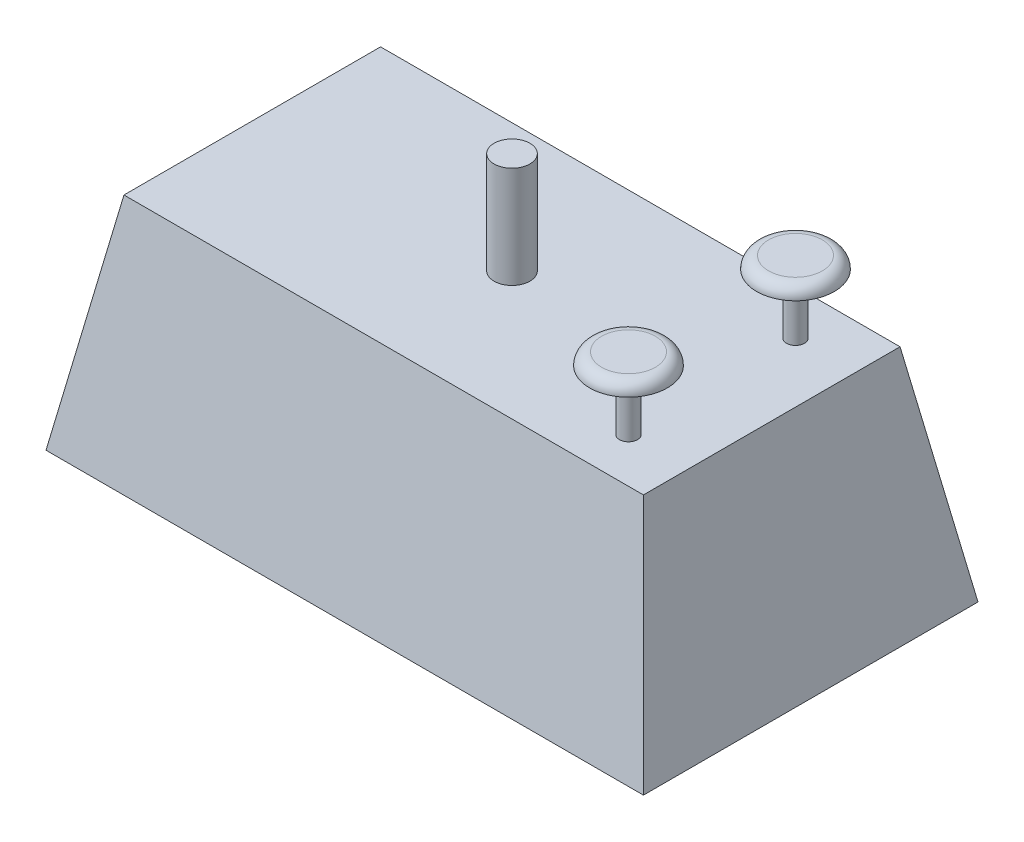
SolidWorks part; units mm, degrees
ref_plane "前视基准面" through (0, 0, 0) normal (0, 0, 1) x (1, 0, 0)
ref_plane "上视基准面" through (0, 0, 0) normal (0, 1, 0) x (1, 0, 0)
ref_plane "右视基准面" through (0, 0, 0) normal (1, 0, 0) x (0, 0, -1)
other "Configuration Table"
sketch "草图1" plane through (0, 0, 0) normal (0, 1, 0) x (1, 0, 0)
  line L1 (-500, 280) -> (500, 280)
  line L2 (-500, 280) -> (-500, -280)
  line L3 (-500, -280) -> (500, -280)
  line L4 (500, 280) -> (500, -280)
  dimension "D1" = 1000
  dimension "D2" = 560
  dimension "D3" = 500
  dimension "D4" = 280
extrude "凸台-拉伸1" add sketch "草图1" along normal blind 370 draft 10
sketch "草图2" plane through (0, 0, 0) normal (0, -1, 0) x (1, 0, 0)
  line L0 (500, -280) -> (-500, -280) construction
  line L1 (-500, 280) -> (500, 280) construction
  line L2 (-500, -280) -> (-500, 280) construction
  circle A0 centre (-320, 235) radius 25
  circle A1 centre (320, 235) radius 25
  circle A2 centre (-320, -235) radius 25
  circle A3 centre (320, -235) radius 25
  dimension "D1" = 50
  dimension "D2" = 50
  dimension "D3" = 50
  dimension "D4" = 50
  dimension "D5" = 45
  dimension "D6" = 0
  dimension "D7" = 45
  dimension "D8" = 0
  dimension "D9" = 180
  dimension "D10" = 0
  dimension "D11" = 640
  dimension "D12" = 0
extrude "凸台-拉伸2" add sketch "草图2" along normal blind 10
sketch "草图3" plane through (0, 370, 0) normal (0, 1, 0) x (1, 0, 0)
  line L0 (434.759, 214.759) -> (-434.759, 214.759) construction
  line L1 (-434.759, -214.759) -> (434.759, -214.759) construction
  line L2 (434.759, -214.759) -> (434.759, 214.759) construction
  circle A0 centre (334.759, 139.759) radius 15
  circle A1 centre (334.759, -139.759) radius 15
  dimension "D1" = 30
  dimension "D2" = 30
  dimension "D3" = 75
  dimension "D4" = 75
  dimension "D5" = 100
  dimension "D6" = 0
extrude "凸台-拉伸3" add sketch "草图3" along normal blind 100
sketch "草图4" plane through (0, 470, 0) normal (0, 1, 0) x (1, 0, 0)
  circle A0 centre (334.759, -139.759) radius 65
  circle A1 centre (334.759, 139.759) radius 65
  dimension "D1" = 130
  dimension "D2" = 130
extrude "凸台-拉伸4" add sketch "草图4" along normal blind 20
fillet "圆角2" radius 20 2 edges at (334.759, 490, 204.759) (334.759, 490, -74.759)
sketch "草图7" plane through (0, 370, 0) normal (0, 1, 0) x (1, 0, 0)
  circle A0 centre (0, 0) radius 30
  dimension "D1" = 60
extrude "凸台-拉伸7" add sketch "草图7" along normal blind 170
